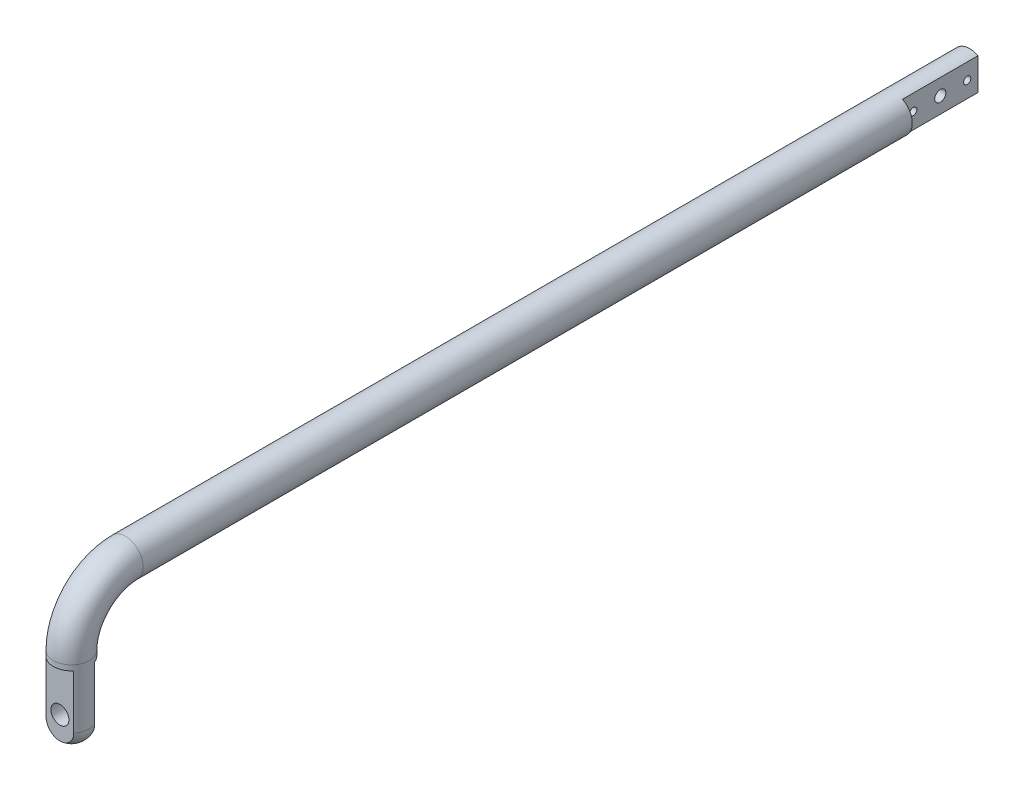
SolidWorks part; units mm, degrees
ref_plane "Plan de face" through (0, 0, 0) normal (0, 0, 1) x (1, 0, 0)
ref_plane "Plan de dessus" through (0, 0, 0) normal (0, 1, 0) x (1, 0, 0)
ref_plane "Plan de droite" through (0, 0, 0) normal (1, 0, 0) x (0, 0, -1)
sketch "Esquisse1" plane through (0, 0, 0) normal (0, 0, 1) x (1, 0, 0)
  circle A0 centre (0, 0) radius 5
sketch "Esquisse10" plane through (0, 0, 0) normal (1, 0, 0) x (0, 0, -1)
  line L0 (18.1857, 0) -> (-255.8854, 0) construction
  line L1 (-250, 22.7398) -> (-250, -43.8111) construction
  line L2 (-255.8854, -36.44) -> (-200.7811, -36.44) construction
  line L3 (0, 22.7398) -> (0, -10.0157) construction
  line L4 (0, 0) -> (-235, 0)
  line L5 (-250, -15) -> (-250, -36.44)
  arc A0 (-235, 0) -> (-250, -15) centre (-235, -15) ccw
  dimension "D3" = 15
  dimension "D1" = 250
  dimension "D2" = 36.44
sweep "Balayage1" add profiles "Esquisse1" path "Esquisse10"
fillet "Congé1" radius 5 1 edges at (5, -36.44, 250)
sketch "Esquisse11" plane through (0, 0, 0) normal (0, 1, 0) x (1, 0, 0)
  line L0 (21.5094, 0) -> (-9.9736, 0) construction
  line L1 (21.5094, -21) -> (-9.9736, -21) construction
  line L2 (-5, 4.0585) -> (-5, -30.9623) construction
  line L3 (2.3, 4.0585) -> (2.3, -30.9623) construction
  line L5 (2.3, -21) -> (5.7679, -21)
  line L6 (2.3, -21) -> (2.3, 0.4579)
  line L7 (2.3, 0.4579) -> (5.7679, 0.4579)
  line L8 (5.7679, -21) -> (5.7679, 0.4579)
  dimension "D1" = 21
  dimension "D2" = 7.3
extrude "Enlèv. mat.-Extru.1" cut sketch "Esquisse11" against normal mid plane 10
sketch "Esquisse12" plane through (2.3, 0, 0) normal (1, 0, 0) x (0, 0, -1)
  line L0 (3.9934, 0) -> (-27.9654, 0) construction
  line L1 (0, 9.3077) -> (0, -13.8468) construction
  line L2 (-10.5, -13.8468) -> (-10.5, 3.4151) construction
  circle A0 centre (-10.5, 0) radius 1.55
  dimension "D1" = 10.5
extrude "Enlèv. mat.-Extru.2" cut sketch "Esquisse12" against normal up to next
sketch "Esquisse13" plane through (2.3, 0, 0) normal (1, 0, 0) x (0, 0, -1)
  line L0 (0, -10.2706) -> (0, 6.7003) construction
  line L1 (1.6083, 0) -> (-13.7773, 0) construction
  line L2 (-10.5, -10.2706) -> (-10.5, 6.7003) construction
  line L3 (-3, -10.2706) -> (-3, 2.2244) construction
  circle A0 centre (-3, 0) radius 1
  circle A1 centre (-18, 0) radius 1
  dimension "D1" = 7.5
extrude "Enlèv. mat.-Extru.3" cut sketch "Esquisse13" against normal blind 2
sketch "Esquisse14" plane through (0, 0, 0) normal (1, 0, 0) x (0, 0, -1)
  line L0 (-273.401, -36.44) -> (-242.2628, -36.44) construction
  line L1 (-273.401, -16.44) -> (-242.2628, -16.44) construction
  line L2 (-245, -50.4435) -> (-245, 12.3667) construction
  line L3 (-248.2, -50.4435) -> (-248.2, 4.0039) construction
  line L4 (-253.2, -50.4435) -> (-253.2, 4.0039) construction
  line L6 (-248.2, -36.44) -> (-245, -36.44)
  line L7 (-248.2, -36.44) -> (-248.2, -16.44)
  line L8 (-248.2, -16.44) -> (-245, -16.44)
  line L9 (-245, -36.44) -> (-245, -16.44)
  line L10 (-253.2, -36.44) -> (-255.0135, -36.44)
  line L11 (-253.2, -36.44) -> (-253.2, -16.44)
  line L12 (-253.2, -16.44) -> (-255.0135, -16.44)
  line L13 (-255.0135, -36.44) -> (-255.0135, -16.44)
  dimension "D1" = 20
  dimension "D2" = 3.2
  dimension "D3" = 5
extrude "Enlèv. mat.-Extru.4" cut sketch "Esquisse14" against normal mid plane 10
sketch "Esquisse15" plane through (0, 0, 248.2) normal (0, 0, -1) x (-1, 0, 0)
  line L0 (0, -40.9781) -> (0, -27.284) construction
  line L1 (8.8519, -36.44) -> (-12.863, -36.44) construction
  line L2 (-12.863, -28.94) -> (2.657, -28.94) construction
  circle A0 centre (0, -28.94) radius 2.5
  dimension "D1" = 7.5
extrude "Enlèv. mat.-Extru.5" cut sketch "Esquisse15" against normal up to next
